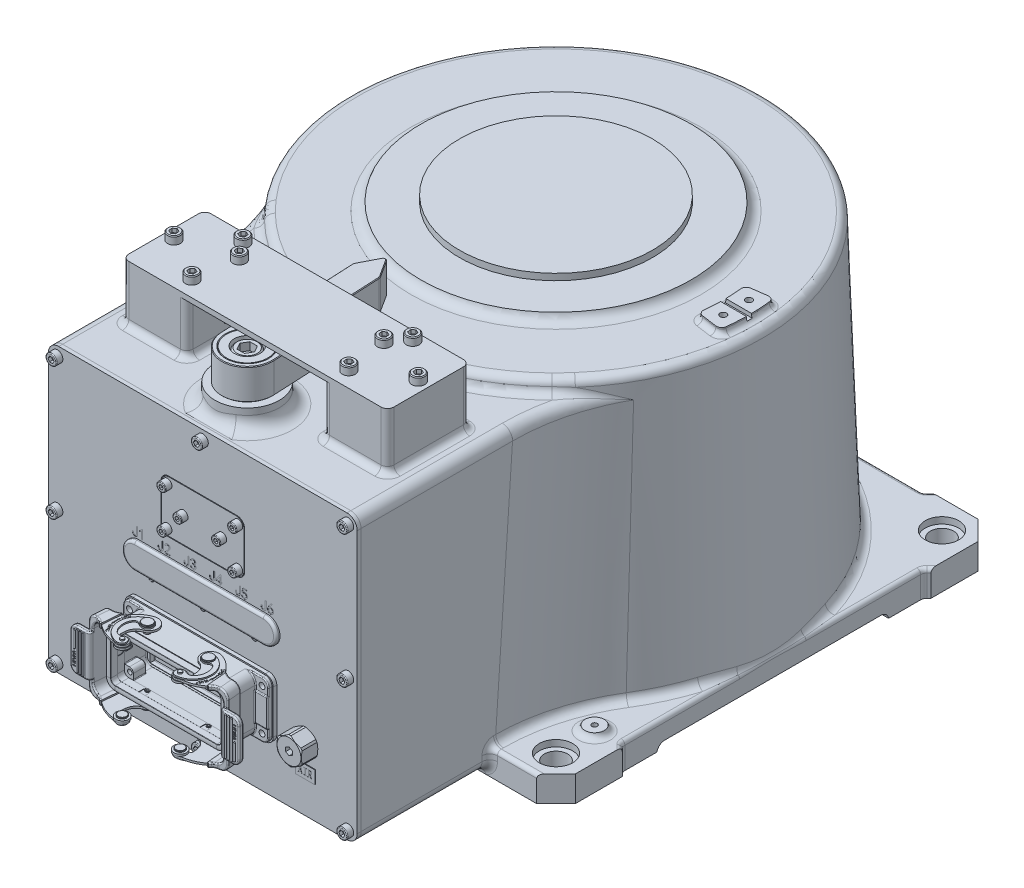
SolidWorks part; units mm, degrees
other "NONE"
other "<GBT-P20A-100.30-0100>-<圆角5>"
ref_plane "前视基准面" through (0, 0, 0) normal (0, 0, 1) x (1, 0, 0)
ref_plane "上视基准面" through (0, 0, 0) normal (0, 1, 0) x (1, 0, 0)
ref_plane "右视基准面" through (0, 0, 0) normal (1, 0, 0) x (0, 0, -1)
imported_body "输入1"
imported_body "输入2"
split "分割1" bodies to split 106 resulting bodies 108 109
split "分割2" bodies to split 109 resulting bodies 110 111 112
ref_plane "基准面1" through (0, 0, 271.5) normal (0, 0, 1) x (1, 0, 0)
split "分割3" trim tools "基准面1" bodies to split 112 resulting bodies 113 114
